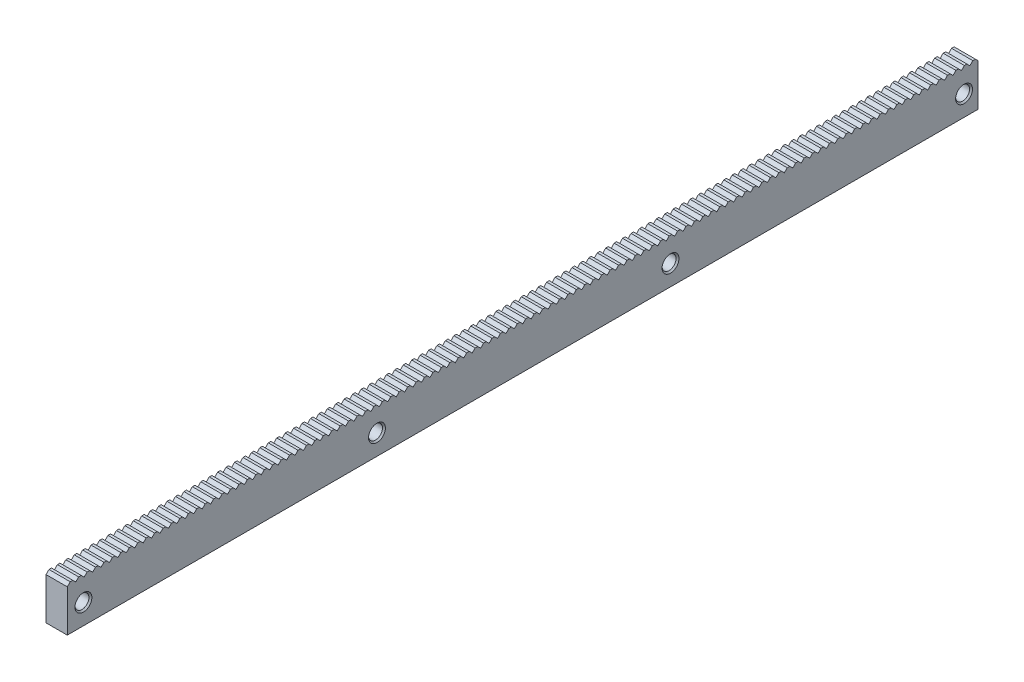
SolidWorks part; units mm, degrees
ref_plane "Front Plane" through (0, 0, 0) normal (0, 0, 1) x (1, 0, 0)
ref_plane "Top Plane" through (0, 0, 0) normal (0, 1, 0) x (1, 0, 0)
ref_plane "Right Plane" through (0, 0, 0) normal (1, 0, 0) x (0, 0, -1)
sketch "Sketch1" plane through (0, 0, 0) normal (1, 0, 0) x (0, 0, -1)
  line L1 (124.1, -6.1) -> (-124.1, -6.1)
  line L2 (124.1, -6.1) -> (124.1, 6.1)
  line L3 (124.1, 6.1) -> (-124.1, 6.1)
  line L4 (-124.1, -6.1) -> (-124.1, 6.1)
  line L5 (124.1, -6.1) -> (-124.1, 6.1) construction
  line L6 (124.1, 6.1) -> (-124.1, -6.1) construction
  point P0 (0, 0)
  dimension "D1" = 248.2
  dimension "D2" = 12.2
extrude "Boss-Extrude1" add sketch "Sketch1" along normal mid plane 5.8
sketch "Sketch2" plane through (0, 0, 0) normal (1, 0, 0) x (0, 0, -1)
  line L0 (-124.1, 5.3) -> (-124.9, 6.1)
  line L1 (-124.1, 6.1) -> (-124.1, -6.1) construction
  line L2 (-124.9, 6.1) -> (-123.3, 6.1)
  line L3 (124.1, 6.1) -> (-124.1, 6.1) construction
  line L4 (-123.3, 6.1) -> (-124.1, 5.3)
  line L5 (-124.1, -6.1) -> (124.1, -6.1) construction
  point P8 (-124.1, 5.3)
  dimension "D1" = 11.4
extrude "Cut-Extrude1" cut sketch "Sketch2" against normal mid plane 5.8
pattern_linear "LPattern1" count 109 spacing 2.299 along (0, -0.7071, -0.7071) of "Cut-Extrude1"
sketch "Sketch3" plane through (0, 0, 0) normal (1, 0, 0) x (0, 0, -1)
  line L0 (-124.1, -6.1) -> (124.1, -6.1) construction
  line L1 (-124.1, 5.3) -> (-124.1, -6.1) construction
  circle A0 centre (-119.7, -0.56) radius 1.9
  dimension "D3" = 3.8
  dimension "D1" = 5.54
  dimension "D2" = 4.4
extrude "Cut-Extrude2" cut sketch "Sketch3" against normal mid plane 5.8
chamfer "Chamfer1" distance 0.4 angle 45 2 edges at (-2.9, -0.56, 117.8) (2.9, -0.56, 117.8)
pattern_linear "LPattern2" count 4 spacing 80 along (0, 0, -1) of "Cut-Extrude2", "Chamfer1"
